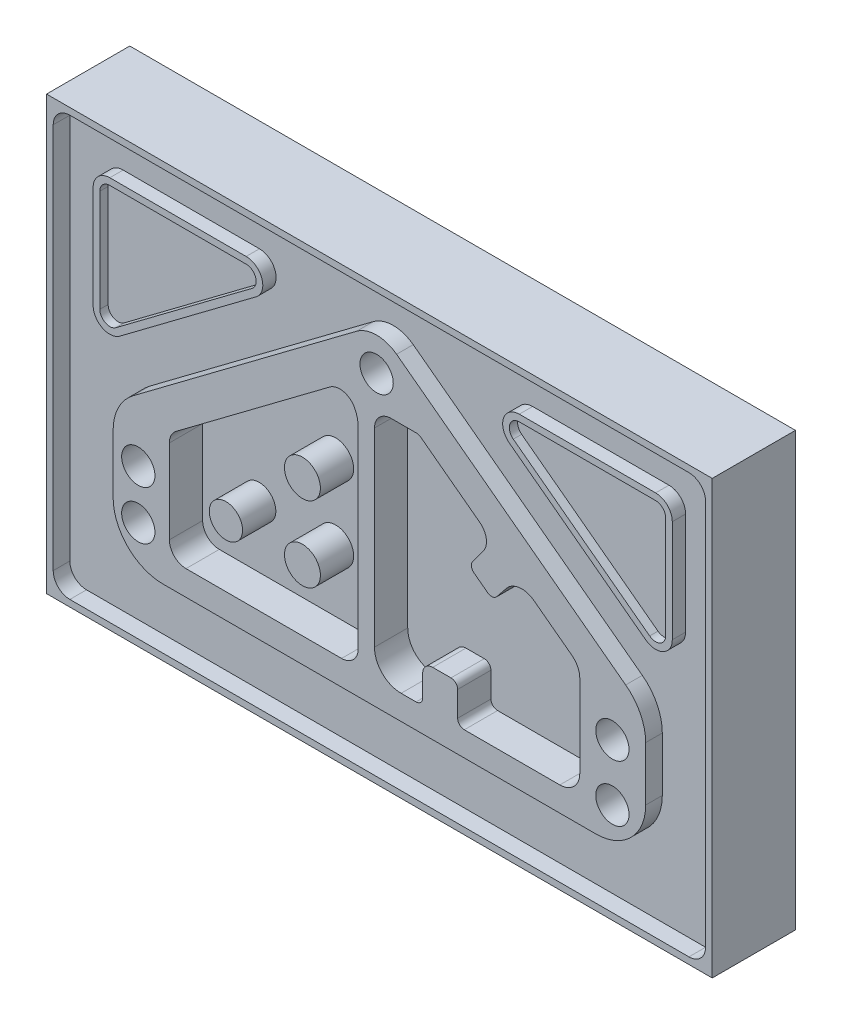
SolidWorks part; units mm, degrees
ref_plane "Plane1" through (0, 0, 0) normal (0, 0, 1) x (1, 0, 0)
ref_plane "Plane2" through (0, 0, 0) normal (0, 1, 0) x (-1, 0, 0)
ref_plane "Plane3" through (0, 0, 0) normal (1, 0, 0) x (0, 0, -1)
sketch "Sketch1" plane through (0, 0, 0) normal (0, 0, 1) x (1, 0, 0)
  line L4 (-13.6667, 109.75) -> (-148, 9)
  line L5 (10.3333, 109.75) -> (148, 6.5)
  line L6 (-160, -15) -> (-160, -50)
  line L7 (160, -17.5) -> (160, -50)
  line L8 (130, -80) -> (-130, -80)
  arc A0 (10.3333, 109.75) -> (-13.6667, 109.75) centre (-1.6667, 93.75) ccw
  arc A1 (-160, -15) -> (-148, 9) centre (-130, -15) cw
  arc A2 (-130, -80) -> (-160, -50) centre (-130, -50) cw
  arc A3 (130, -80) -> (160, -50) centre (130, -50) ccw
  arc A4 (160, -17.5) -> (148, 6.5) centre (130, -17.5) ccw
  dimension "D1" = 20
  dimension "D2" = 30
  dimension "D3" = 30
  dimension "D4" = 30
  dimension "D5" = 30
extrude "Base - Triangle" add sketch "Sketch1" along normal blind 50
sketch "Sketch5" plane through (0, 0, 0) normal (0, 0, 1) x (1, 0, 0)
  line L0 (-200, -120) -> (200, -120)
  line L1 (-200, -120) -> (-200, 140)
  line L2 (200, 140) -> (-200, 140)
  line L3 (200, 140) -> (200, -120)
extrude "Base - Rectangle" add sketch "Sketch5" along normal blind 40
sketch "Sketch2" plane through (0, 0, 50) normal (0, 0, 1) x (1, 0, 0)
  line L1 (-126.2039, -4.6529) -> (-126.2039, -55.0614)
  line L2 (-116.2039, -65.0614) -> (-22.7292, -65.0614)
  line L3 (-12.7292, -55.0614) -> (-12.7292, 60.2006)
  line L4 (-2.9691, 64.7239) -> (-2.9691, -49.3197)
  line L5 (7.0309, 74.7239) -> (22.3681, 74.7239)
  line L6 (24.7681, 73.9239) -> (60.344, 47.242)
  line L7 (62.344, 33.242) -> (56.03, 24.8234)
  line L8 (56.83, 19.2234) -> (65.0483, 13.0597)
  line L9 (70.5716, 13.7606) -> (76.2126, 20.8105)
  line L10 (13.0309, -65.3197) -> (22.0119, -65.3197)
  line L11 (120.4179, -3.8135) -> (120.4179, -53.3197)
  line L12 (26.0119, -61.3197) -> (26.0119, -48.3197)
  line L13 (32.0119, -42.3197) -> (43.0119, -42.3197)
  line L14 (47.0119, -46.3197) -> (47.0119, -61.3197)
  line L15 (92.7823, 22.9133) -> (115.6179, 5.7865)
  line L16 (51.0119, -65.3197) -> (108.4179, -65.3197)
  line L17 (-29.7808, 72.6644) -> (-122.2039, 3.3471)
  line L18 (10.3333, 109.75) -> (148, 6.5) construction
  line L19 (-13.6667, 109.75) -> (-148, 9) construction
  arc A0 (-12.7292, 60.2006) -> (-14.8324, 69.1283) centre (-32.7292, 60.2006) ccw
  arc A1 (-126.2039, -4.6529) -> (-122.2039, 3.3471) centre (-116.2039, -4.6529) cw
  arc A2 (-116.2039, -65.0614) -> (-126.2039, -55.0614) centre (-116.2039, -55.0614) cw
  arc A3 (-22.7292, -65.0614) -> (-12.7292, -55.0614) centre (-22.7292, -55.0614) ccw
  arc A4 (-2.9691, 64.7239) -> (7.0309, 74.7239) centre (7.0309, 64.7239) cw
  arc A5 (62.344, 33.242) -> (60.344, 47.242) centre (54.344, 39.242) ccw
  arc A6 (56.83, 19.2234) -> (56.03, 24.8234) centre (59.23, 22.4234) cw
  arc A7 (70.5716, 13.7606) -> (65.0483, 13.0597) centre (67.4483, 16.2597) cw
  arc A8 (92.7823, 22.9133) -> (76.2126, 20.8105) centre (85.5823, 13.3133) ccw
  arc A9 (120.4179, -3.8135) -> (115.6179, 5.7865) centre (108.4179, -3.8135) ccw
  arc A10 (108.4179, -65.3197) -> (120.4179, -53.3197) centre (108.4179, -53.3197) ccw
  arc A11 (51.0119, -65.3197) -> (47.0119, -61.3197) centre (51.0119, -61.3197) cw
  arc A12 (43.0119, -42.3197) -> (47.0119, -46.3197) centre (43.0119, -46.3197) cw
  arc A13 (26.0119, -48.3197) -> (32.0119, -42.3197) centre (32.0119, -48.3197) cw
  arc A14 (-2.9691, -49.3197) -> (13.0309, -65.3197) centre (13.0309, -49.3197) ccw
  arc A15 (26.0119, -61.3197) -> (22.0119, -65.3197) centre (22.0119, -61.3197) cw
  arc A16 (22.3681, 74.7239) -> (24.7681, 73.9239) centre (22.3681, 70.7239) cw
  arc A17 (-29.7808, 72.6644) -> (-14.8324, 69.1283) centre (-23.7808, 64.6644) cw
  dimension "D1" = 20
  dimension "D2" = 10
  dimension "D3" = 10
  dimension "D4" = 10
  dimension "D5" = 10
  dimension "D6" = 10
  dimension "D7" = 4
  dimension "D8" = 4
  dimension "D9" = 12
  dimension "D10" = 12
  dimension "D11" = 12
  dimension "D12" = 4
  dimension "D13" = 4
  dimension "D14" = 6
  dimension "D15" = 16
  dimension "D16" = 4
  dimension "D17" = 4
  dimension "D18" = 10
  dimension "D19" = 20
  dimension "D20" = 20
extrude "Pockets" cut sketch "Sketch2" against normal blind 20
sketch "Sketch3" plane through (0, 0, 50) normal (0, 0, 1) x (1, 0, 0)
  circle A0 centre (-144.8804, -26.0834) radius 10
  circle A1 centre (-144.8804, -55.4543) radius 10
  circle A2 centre (140, -26.0834) radius 10
  circle A3 centre (140, -60) radius 10
  circle A4 centre (-1.6667, 93.75) radius 10
extrude "Cut - Holes" cut sketch "Sketch3" against normal blind 40
sketch "Sketch4" plane through (0, 0, 30) normal (0, 0, 1) x (1, 0, 0)
  circle A0 centre (-46.2462, 17.1616) radius 10.7866
  circle A1 centre (-46.2462, -28.1718) radius 10.7866
  circle A2 centre (-92.2225, -28.1718) radius 10
extrude "Pocket Boss'" add sketch "Sketch4" along normal blind 20
sketch "Sketch6" plane through (0, 0, 40) normal (0, 0, 1) x (1, 0, 0)
  line L4 (-196, 136) -> (-196, -116)
  line L5 (-196, -116) -> (196, -116)
  line L6 (196, -116) -> (196, 136)
  line L7 (196, 136) -> (-196, 136)
  line L8 (-196, 126) -> (-196, -106)
  line L9 (-186, -116) -> (186, -116)
  line L10 (196, -106) -> (196, 126)
  line L11 (186, 136) -> (-186, 136)
  line L12 (-200, 140) -> (-200, -120)
  line L13 (-200, -120) -> (200, -120)
  line L14 (200, -120) -> (200, 140)
  line L15 (200, 140) -> (-200, 140)
  line L16 (-200, 140) -> (-200, -120)
  line L17 (-200, -120) -> (200, -120)
  line L18 (200, -120) -> (200, 140)
  line L19 (200, 140) -> (-200, 140)
  arc A0 (-196, 126) -> (-186, 136) centre (-186, 126) cw
  arc A1 (-186, -116) -> (-196, -106) centre (-186, -106) cw
  arc A2 (196, -106) -> (186, -116) centre (186, -106) cw
  arc A3 (186, 136) -> (196, 126) centre (186, 126) cw
  dimension "D3" = 10
  dimension "D4" = 10
  dimension "D5" = 10
  dimension "D6" = 10
  dimension "D1" = 4
  dimension "D2" = 0
extrude "Rim" add sketch "Sketch6" along normal blind 10
sketch "Sketch7" plane through (0, 0, 40) normal (0, 0, 1) x (1, 0, 0)
  line L0 (-164, 113.4481) -> (-82.0692, 113.4481)
  line L1 (-174, 103.4481) -> (-174, 42)
  line L2 (-158, 34) -> (-76.0692, 95.4481)
  line L3 (0, 140) -> (0, -120) construction
  line L4 (158, 34) -> (76.0692, 95.4481)
  line L5 (174, 103.4481) -> (174, 42)
  line L6 (164, 113.4481) -> (82.0692, 113.4481)
  arc A0 (-82.0692, 113.4481) -> (-76.0692, 95.4481) centre (-82.0692, 103.4481) cw
  arc A1 (-174, 103.4481) -> (-164, 113.4481) centre (-164, 103.4481) cw
  arc A2 (-158, 34) -> (-174, 42) centre (-164, 42) cw
  arc A3 (158, 34) -> (174, 42) centre (164, 42) ccw
  arc A4 (174, 103.4481) -> (164, 113.4481) centre (164, 103.4481) ccw
  arc A5 (82.0692, 113.4481) -> (76.0692, 95.4481) centre (82.0692, 103.4481) ccw
  dimension "D1" = 10
  dimension "D2" = 10
  dimension "D3" = 10
extrude "Tri - Boss'" add sketch "Sketch7" along normal blind 8
sketch "Sketch8" plane through (0, 0, 48) normal (0, 0, 1) x (1, 0, 0)
  line L3 (-82.0692, 109.4481) -> (-164, 109.4481)
  line L4 (-170, 103.4481) -> (-170, 42)
  line L5 (-160.4, 37.2) -> (-78.4692, 98.6481)
  line L6 (-82.0692, 109.4481) -> (-164, 109.4481)
  line L7 (-170, 103.4481) -> (-170, 42)
  line L8 (-160.4, 37.2) -> (-78.4692, 98.6481)
  line L9 (170, 42) -> (170, 103.4481)
  line L10 (164, 109.4481) -> (82.0692, 109.4481)
  line L11 (78.4692, 98.6481) -> (160.4, 37.2)
  line L12 (170, 42) -> (170, 103.4481)
  line L13 (164, 109.4481) -> (82.0692, 109.4481)
  line L14 (78.4692, 98.6481) -> (160.4, 37.2)
  arc A3 (-78.4692, 98.6481) -> (-82.0692, 109.4481) centre (-82.0692, 103.4481) ccw
  arc A4 (-164, 109.4481) -> (-170, 103.4481) centre (-164, 103.4481) ccw
  arc A5 (-170, 42) -> (-160.4, 37.2) centre (-164, 42) ccw
  arc A6 (-78.4692, 98.6481) -> (-82.0692, 109.4481) centre (-82.0692, 103.4481) ccw
  arc A7 (-164, 109.4481) -> (-170, 103.4481) centre (-164, 103.4481) ccw
  arc A8 (-170, 42) -> (-160.4, 37.2) centre (-164, 42) ccw
  arc A9 (160.4, 37.2) -> (170, 42) centre (164, 42) ccw
  arc A10 (170, 103.4481) -> (164, 109.4481) centre (164, 103.4481) ccw
  arc A11 (82.0692, 109.4481) -> (78.4692, 98.6481) centre (82.0692, 103.4481) ccw
  arc A12 (160.4, 37.2) -> (170, 42) centre (164, 42) ccw
  arc A13 (170, 103.4481) -> (164, 109.4481) centre (164, 103.4481) ccw
  arc A14 (82.0692, 109.4481) -> (78.4692, 98.6481) centre (82.0692, 103.4481) ccw
  dimension "D1" = 4
  dimension "D2" = 4
extrude "Tri - Pock's" cut sketch "Sketch8" against normal blind 5
